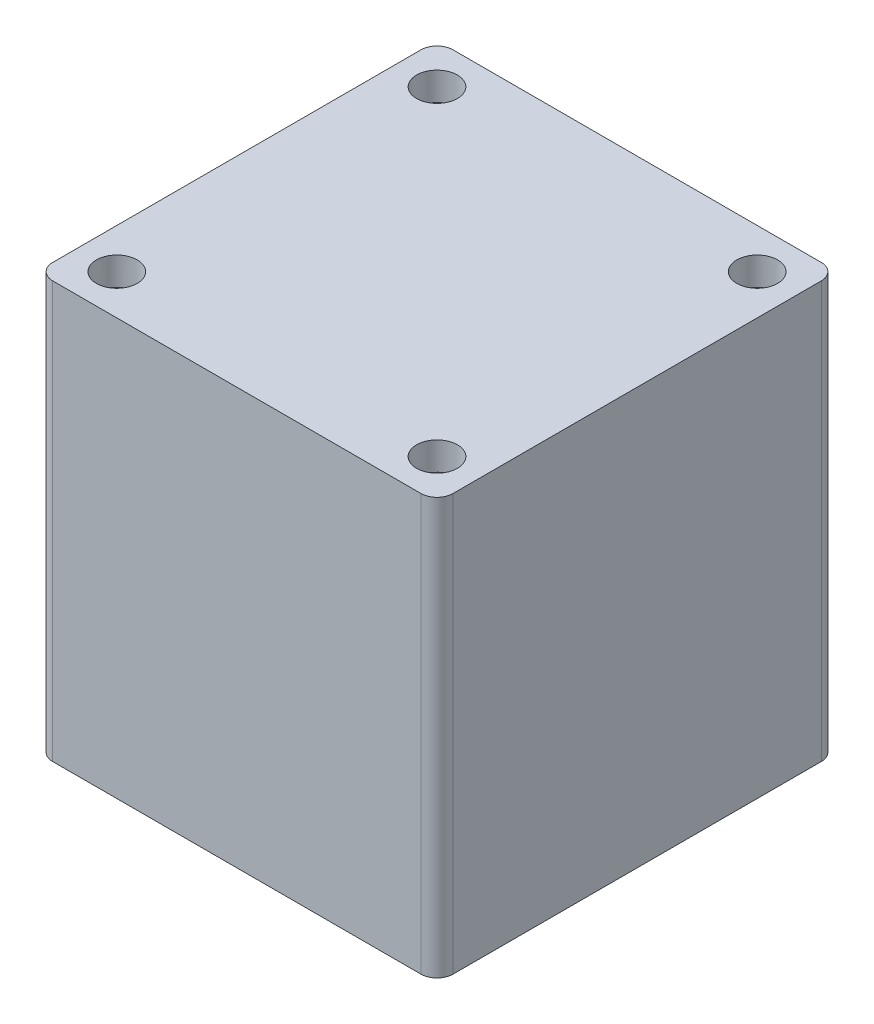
SolidWorks part; units mm, degrees
ref_plane "Front Plane" through (0, 0, 0) normal (0, 0, 1) x (1, 0, 0)
ref_plane "Top Plane" through (0, 0, 0) normal (0, 1, 0) x (1, 0, 0)
ref_plane "Right Plane" through (0, 0, 0) normal (1, 0, 0) x (0, 0, -1)
sketch "Sketch2" plane through (0, 0, 0) normal (0, 1, 0) x (1, 0, 0)
  line L0 (0, -25) -> (0, -20) construction
  line L1 (23, -25) -> (-23, -25)
  line L2 (25, -23) -> (25, 23)
  line L3 (23, 25) -> (5, 25)
  line L4 (-25, -23) -> (-25, -5)
  line L5 (25, -25) -> (-25, 25) construction
  line L6 (25, 25) -> (-25, -25) construction
  line L7 (15, -17.2179) -> (1.25, -17.2179)
  line L8 (17, -15.2179) -> (17, -1.25)
  line L9 (15, 17.2179) -> (-15, 17.2179)
  line L10 (-17, -15.2179) -> (-17, 15.2179)
  line L11 (17, -17.2179) -> (-17, 17.2179) construction
  line L12 (17, 17.2179) -> (-17, -17.2179) construction
  line L13 (25, 0) -> (20, 0) construction
  line L23 (0, 25) -> (0, 19.5) construction
  line L27 (-5, 25) -> (-23, 25)
  line L31 (-25, 5) -> (-25, 23)
  line L32 (17, 1.25) -> (17, 15.2179)
  line L33 (-1.25, -17.2179) -> (-15, -17.2179)
  line L34 (-1.25, -17.2179) -> (1.25, -17.2179)
  line L35 (-1.25, -17.2179) -> (1.25, -17.2179)
  line L36 (17, -1.25) -> (17, 1.25)
  line L37 (-25, 5) -> (-25, -5)
  line L38 (-5, 25) -> (5, 25)
  arc A0 (23, -25) -> (25, -23) centre (23, -23) ccw
  arc A1 (25, 23) -> (23, 25) centre (23, 23) ccw
  arc A2 (17, 15.2179) -> (15, 17.2179) centre (15, 15.2179) ccw
  arc A3 (15, -17.2179) -> (17, -15.2179) centre (15, -15.2179) ccw
  arc A4 (-15, -17.2179) -> (-17, -15.2179) centre (-15, -15.2179) cw
  arc A5 (-23, -25) -> (-25, -23) centre (-23, -23) cw
  arc A6 (-15, 17.2179) -> (-17, 15.2179) centre (-15, 15.2179) ccw
  arc A7 (-23, 25) -> (-25, 23) centre (-23, 23) ccw
  circle A18 centre (-20, -20) radius 2.55
  circle A19 centre (-20, 20) radius 2.55
  circle A20 centre (20, 20) radius 2.55
  circle A21 centre (20, -20) radius 2.55
  point P0 (0, 0)
  point P6 (0, 0)
  point P82 (0, 0)
  point P91 (0, 0)
  dimension "D4" = 2
  dimension "D26" = 5.1
  dimension "D27" = 5.1
  dimension "D1" = 50
  dimension "D2" = 50
  dimension "D3" = 34
  dimension "D5" = 5
  dimension "D6" = 5
  dimension "D28" = 5
  dimension "D29" = 4
  dimension "D30" = 5
  dimension "D31" = 5
  dimension "D32" = 5
  dimension "D35" = 13.75
extrude "Boss-Extrude2" add sketch "Sketch2" along normal blind 8
sketch "Sketch5" plane through (0, 0, 0) normal (0, -1, 0) x (1, 0, 0)
  circle A0 centre (-20, 20) radius 3
  circle A1 centre (20, 20) radius 3
  circle A2 centre (20, -20) radius 3
  circle A3 centre (-20, -20) radius 3
  dimension "D1" = 6
extrude "Boss-Extrude3" add sketch "Sketch5" against normal blind 4.5
sketch "Sketch6" plane through (0, 0, 0) normal (0, -1, 0) x (1, 0, 0)
  line L8 (-23, -25) -> (23, -25)
  line L9 (25, -23) -> (25, 23)
  line L10 (23, 25) -> (-23, 25)
  line L11 (-25, 23) -> (-25, -23)
  line L12 (-23, -25) -> (23, -25)
  line L13 (25, -23) -> (25, 23)
  line L14 (23, 25) -> (-23, 25)
  line L16 (-22, 22) -> (-25, 22)
  line L17 (-25, 23) -> (-25, -23) construction
  line L18 (-25, 22) -> (-25, 23)
  line L19 (-22, -22) -> (-25, -22)
  line L20 (-22, -22) -> (22, -22)
  line L21 (22, -22) -> (22, 22)
  line L22 (22, 22) -> (-22, 22)
  line L23 (-22, 22) -> (-22, -22)
  line L24 (-22, -22) -> (22, -22)
  line L25 (22, -22) -> (22, 22)
  line L26 (22, 22) -> (-22, 22)
  line L28 (-25, -22) -> (-25, -23)
  arc A8 (23, -25) -> (25, -23) centre (23, -23) ccw
  arc A9 (25, 23) -> (23, 25) centre (23, 23) ccw
  arc A10 (-23, 25) -> (-25, 23) centre (-23, 23) ccw
  arc A11 (-25, -23) -> (-23, -25) centre (-23, -23) ccw
  arc A12 (23, -25) -> (25, -23) centre (23, -23) ccw
  arc A13 (25, 23) -> (23, 25) centre (23, 23) ccw
  arc A14 (-23, 25) -> (-25, 23) centre (-23, 23) ccw
  arc A15 (-25, -23) -> (-23, -25) centre (-23, -23) ccw
  dimension "D1" = 0
  dimension "D2" = 3
extrude "Boss-Extrude4" add sketch "Sketch6" along normal blind 42
sketch "Sketch7" plane through (0, 0, 0) normal (0, -1, 0) x (1, 0, 0)
  line L0 (-25, 22) -> (3.2843, -6.2843)
  line L1 (3.2843, -6.2843) -> (5.4056, -4.163)
  line L2 (5.4056, -4.163) -> (-20.7574, 22)
  line L3 (-25, 22) -> (22, 22) construction
  line L4 (-20.7574, 22) -> (-25, 22)
  line L5 (-25, -22) -> (-12.5, -22) construction
  line L6 (4.7426, -22) -> (4.7426, -13.5099) construction
  line L7 (8.9853, -22) -> (21.7132, -9.2721)
  line L8 (22, -22) -> (-25, -22) construction
  line L9 (19.5919, -7.1508) -> (4.7426, -22)
  line L10 (-10.1066, -7.1508) -> (4.7426, -22)
  line L11 (8.9853, -22) -> (0.5, -22)
  line L12 (22, -22) -> (-25, -22) construction
  line L13 (0.5, -22) -> (-12.2279, -9.2721)
  line L14 (-12.2279, -9.2721) -> (-10.1066, -7.1508)
  line L16 (19.5919, -7.1508) -> (22, -4.7426)
  line L17 (22, 22) -> (22, -22) construction
  line L18 (21.7132, -9.2721) -> (22, -8.9853)
  line L19 (22, -8.9853) -> (22, -4.7426)
  line L20 (4.7426, -22) -> (8.9853, -22)
  line L21 (22, -4.7426) -> (-4.7426, 22)
  line L22 (-4.7426, 22) -> (-0.5, 22)
  line L23 (-0.5, 22) -> (22, -0.5)
  line L24 (22, 22) -> (22, -22) construction
  line L25 (22, -0.5) -> (22, -4.7426)
  line L26 (-10.1066, -7.1508) -> (-25, -7.1508)
  line L27 (-25, 22) -> (-25, -22) construction
  line L28 (-25, -7.1508) -> (-25, -22)
  line L29 (-25, -22) -> (-22, -22)
  line L30 (-22, -22) -> (-22, -9.2721)
  line L31 (-22, -9.2721) -> (-12.2279, -9.2721)
  dimension "D1" = 3
  dimension "D2" = 40
  dimension "D3" = 45
  dimension "D4" = 12.5
  dimension "D5" = 3
  dimension "D6" = 45
  dimension "D7" = 18
  dimension "D8" = 13
  dimension "D9" = 3
  dimension "D10" = 3
extrude "Boss-Extrude5" add sketch "Sketch7" along normal up to surface (42 mm away) contours L30 L31 L14 L26 M18 M15 | L14 L13 L10 M15 | L1 L2 L0 M17 | L23 L21 M17 M16 | L7 L18 L16 L9 M16 M15
sketch "Sketch9" plane through (0, -42, 0) normal (0, -1, 0) x (1, 0, 0)
  line L0 (-23, -25) -> (23, -25) construction
  line L1 (25, -23) -> (25, 23) construction
  line L2 (23, 25) -> (-23, 25) construction
  line L3 (-23, -25) -> (23, -25)
  line L4 (25, -23) -> (25, 23)
  line L5 (23, 25) -> (-23, 25)
  line L6 (-25, 23) -> (-25, -23)
  arc A0 (-25, -23) -> (-23, -25) centre (-23, -23) ccw construction
  arc A1 (23, -25) -> (25, -23) centre (23, -23) ccw construction
  arc A2 (25, 23) -> (23, 25) centre (23, 23) ccw construction
  arc A3 (-23, 25) -> (-25, 23) centre (-23, 23) ccw construction
  arc A4 (-25, -23) -> (-23, -25) centre (-23, -23) ccw
  arc A5 (23, -25) -> (25, -23) centre (23, -23) ccw
  arc A6 (25, 23) -> (23, 25) centre (23, 23) ccw
  arc A7 (-23, 25) -> (-25, 23) centre (-23, 23) ccw
extrude "Boss-Extrude6" add sketch "Sketch9" along normal blind 2
